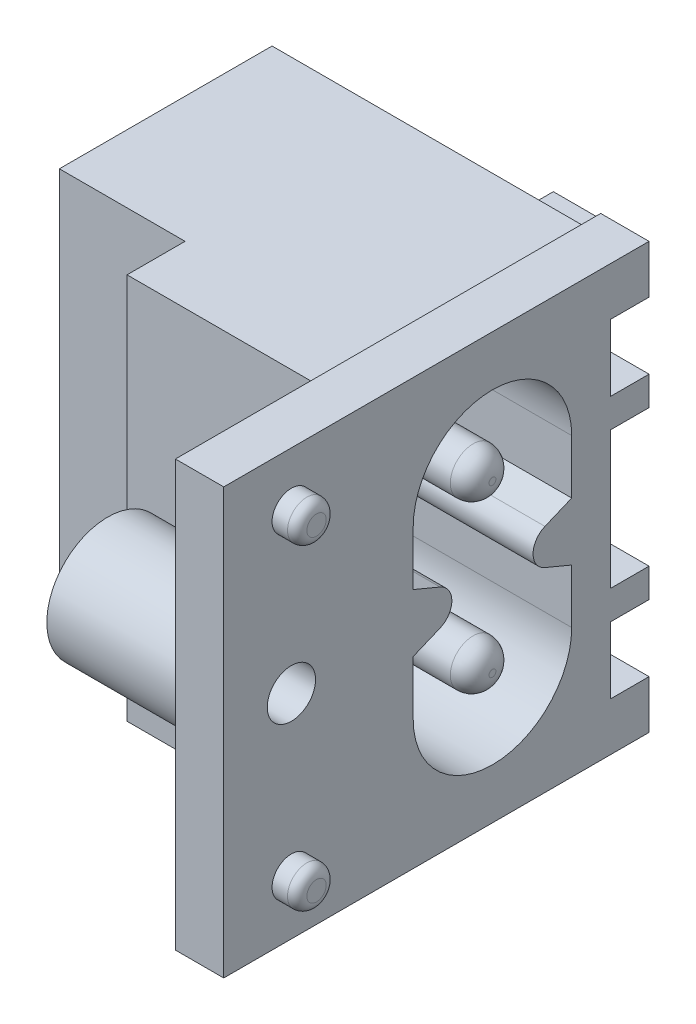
SolidWorks part; units mm, degrees
ref_plane "Front Plane" through (0, 0, 0) normal (0, 0, 1) x (1, 0, 0)
ref_plane "Top Plane" through (0, 0, 0) normal (0, 1, 0) x (1, 0, 0)
ref_plane "Right Plane" through (0, 0, 0) normal (1, 0, 0) x (0, 0, -1)
sketch "Sketch1" plane through (0, 0, 0) normal (0, 0, 1) x (1, 0, 0)
  line L0 (-19.5, 10) -> (-2.5, 10)
  line L1 (-2.5, 11) -> (0, 11)
  line L2 (-19.5, 10) -> (-19.5, -10)
  line L3 (-2.5, -11) -> (0, -11)
  line L4 (0, 11) -> (0, -11)
  line L5 (-2.5, 10) -> (-2.5, 11)
  line L6 (-19.5, -10) -> (-2.5, -10)
  line L7 (-2.5, -10) -> (-2.5, -11)
  line L8 (0, 0) -> (-19.5, 0) construction
  point P4 (0, 0)
  dimension "D1" = 19.5
  dimension "D2" = 22
  dimension "D3" = 20
  dimension "D4" = 2.5
extrude "Boss-Extrude1" add sketch "Sketch1" along normal blind 22
sketch "Sketch5" plane through (0, 0, 0) normal (1, 0, 0) x (0, 0, -1)
  line L0 (-22, 0) -> (0, 0) construction
  line L1 (-22, -11) -> (-22, 11) construction
  line L2 (-8.1, -4.3) -> (-8.1, 4.3) construction
  line L3 (-12.2, -4.3) -> (-12.2, -1.5)
  line L4 (-12.2, -1.5) -> (-10.8154, -0.9231)
  line L5 (-10.8154, 0.9231) -> (-12.2, 1.5)
  line L6 (-12.2, 1.5) -> (-12.2, 4.3)
  line L7 (-4, -4.3) -> (-4, -1.5)
  line L8 (-4, -1.5) -> (-5.3846, -0.9231)
  line L9 (-5.3846, 0.9231) -> (-4, 1.5)
  line L10 (-4, 1.5) -> (-4, 4.3)
  line L11 (-12.2, -1.5) -> (-12.2, 1.5) construction
  circle A0 centre (-8.1, -4.3) radius 1.18
  circle A1 centre (-8.1, 4.3) radius 1.18
  arc A2 (-12.2, -4.3) -> (-4, -4.3) centre (-8.1, -4.3) ccw
  arc A3 (-12.2, 4.3) -> (-4, 4.3) centre (-8.1, 4.3) cw
  arc A4 (-10.8154, -0.9231) -> (-10.8154, 0.9231) centre (-11.2, 0) ccw
  arc A5 (-5.3846, -0.9231) -> (-5.3846, 0.9231) centre (-5, 0) cw
  circle A6 centre (-18.5, 0) radius 1.25
  point P7 (-8.1, 0)
  point P23 (-10.2, 0)
  point P25 (-6, 0)
  point P26 (-12.2, 0)
  dimension "D1" = 2.36
  dimension "D2" = 8.6
  dimension "D3" = 4.2
  dimension "D4" = 1
  dimension "D6" = 8.1
  dimension "D7" = 3
  dimension "D9" = 2.5
  dimension "D5" = 8.2
  dimension "D8" = 18.5
extrude "Cut-Extrude1" cut sketch "Sketch5" against normal blind 10
sketch "Sketch6" plane through (0, 0, 0) normal (0, 1, 0) x (1, 0, 0)
  line L0 (-19.5, -22) -> (-2.5, -22)
  line L1 (-2.5, -22) -> (-2.5, -21.8)
  line L2 (-2.5, -22) -> (-2.5, 0) construction
  line L3 (-2.5, -21.8) -> (-9.5, -21.8)
  line L4 (-9.5, -21.8) -> (-9.5, -14)
  line L5 (-9.5, -14) -> (-13, -14)
  line L6 (-13, -14) -> (-13, -11)
  line L7 (-13, -11) -> (-19.5, -11)
  line L8 (-19.5, -22) -> (-19.5, 0) construction
  line L9 (-19.5, -11) -> (-19.5, -22)
  line L10 (-19.5, 0) -> (-2.5, 0) construction
  line L11 (0, -22) -> (0, 0) construction
  dimension "D1" = 14
  dimension "D2" = 11
  dimension "D3" = 10
  dimension "D4" = 13
  dimension "D5" = 0.2
extrude "Cut-Extrude2" cut sketch "Sketch6" against normal through all and the other way through all
sketch "Sketch7" plane through (0, 0, 0) normal (1, 0, 0) x (0, 0, -1)
  line L0 (-14, 0.75) -> (-15.4406, 0.75)
  line L1 (-14, -10) -> (-14, 10) construction
  line L2 (-14, -0.75) -> (-15.4406, -0.75)
  line L3 (-14, -0.75) -> (-14, -11)
  line L4 (-22, -11) -> (0, -11) construction
  line L5 (-14, -11) -> (-22, -11)
  line L6 (-22, -11) -> (-22, 11)
  line L7 (-22, 11) -> (-14, 11)
  line L8 (-22, 11) -> (0, 11) construction
  line L9 (-14, 11) -> (-14, 0.75)
  line L10 (-15.4406, 0.75) -> (-15.4406, -0.75) construction
  line L11 (-18.5, 0) -> (-15.4406, 0) construction
  arc A0 (-15.4406, 0.75) -> (-15.4406, -0.75) centre (-18.5, 0) ccw
  dimension "D1" = 6.3
  dimension "D2" = 1.5
extrude "Cut-Extrude3" cut sketch "Sketch7" against normal through all from offset 2.5
sketch "Sketch8" plane through (0, 0, 0) normal (1, 0, 0) x (0, 0, -1)
  line L0 (0, 8.5) -> (-9.5, 8.5)
  line L1 (0, 10) -> (0, -10) construction
  line L2 (-9.5, 8.5) -> (-9.5, 0.75)
  line L3 (-9.5, 0.75) -> (-1.8, 0.75)
  line L4 (-1.8, 0.75) -> (-1.8, -0.75)
  line L5 (-1.8, -0.75) -> (-9.5, -0.75)
  line L6 (-9.5, -0.75) -> (-9.5, -8.5)
  line L7 (-9.5, -8.5) -> (0, -8.5)
  line L8 (0, -8.5) -> (0, 8.5)
  line L9 (-5.65, 0.75) -> (-5.65, -0.75) construction
  line L10 (-4.75, 8.5) -> (-4.75, 10) construction
  line L11 (-11, 10) -> (0, 10) construction
  line L12 (-9.5, 4.625) -> (-11, 4.625) construction
  line L13 (-11, -10) -> (-11, 10) construction
  line L14 (-5.65, 0) -> (0, 0) construction
  dimension "D1" = 1.5
  dimension "D2" = 1.8
extrude "Cut-Extrude4" cut sketch "Sketch8" against normal through all from offset 17.81
sketch "Sketch9" plane through (0, 0, 0) normal (0, 0, 1) x (1, 0, 0)
  line L0 (-17.81, 8.5) -> (0, 8.5)
  line L1 (0, -11) -> (0, 11) construction
  line L2 (0, 8.5) -> (0, 5.05)
  line L3 (0, 5.05) -> (-13.31, 5.05)
  line L4 (-13.31, 5.05) -> (-13.31, 6.5)
  line L5 (-13.31, 6.5) -> (-17.81, 6.5)
  line L6 (-17.81, 8.5) -> (-17.81, 0.75) construction
  line L7 (-17.81, 6.5) -> (-17.81, 8.5)
  line L8 (-17.81, -8.5) -> (0, -8.5)
  line L9 (0, -8.5) -> (0, -5.05)
  line L10 (0, -5.05) -> (-13.31, -5.05)
  line L11 (-13.31, -5.05) -> (-13.31, -6.5)
  line L12 (-13.31, -6.5) -> (-17.81, -6.5)
  line L13 (-17.81, -8.5) -> (-17.81, 8.5) construction
  line L14 (-17.81, -6.5) -> (-17.81, -8.5)
  line L16 (0, 3.55) -> (0, -3.55)
  line L17 (0, -3.55) -> (-13.31, -3.55)
  line L18 (-13.31, -3.55) -> (-13.31, -2.1)
  line L19 (-13.31, -2.1) -> (-19.5, -2.1)
  line L20 (-19.5, -0.75) -> (-19.5, -8.5) construction
  line L21 (-19.5, -2.1) -> (-19.5, 2.1)
  line L22 (-19.5, 8.5) -> (-19.5, 0.75) construction
  line L23 (-19.5, 2.1) -> (-13.31, 2.1)
  line L24 (-13.31, 2.1) -> (-13.31, 3.55)
  line L25 (-13.31, 3.55) -> (0, 3.55)
  line L26 (-8.905, 8.5) -> (-8.905, 10) construction
  line L27 (-2.5, 10) -> (-19.5, 10) construction
  line L28 (-6.655, 5.05) -> (-6.655, 3.55) construction
  line L29 (-6.655, -3.55) -> (-6.655, -5.05) construction
  line L30 (-15.7, 5.05) -> (-19.5, 5.05)
  line L31 (-15.7, 5.05) -> (-15.7, 3.55)
  line L32 (-15.7, 3.55) -> (-19.5, 3.55)
  line L33 (-19.5, 5.05) -> (-19.5, 3.55)
  line L34 (-15.7, -3.55) -> (-19.5, -3.55)
  line L35 (-15.7, -3.55) -> (-15.7, -5.05)
  line L36 (-15.7, -5.05) -> (-19.5, -5.05)
  line L37 (-19.5, -3.55) -> (-19.5, -5.05)
  dimension "D1" = 4.5
  dimension "D2" = 3.45
  dimension "D3" = 2
  dimension "D4" = 15.7
extrude "Cut-Extrude5" cut sketch "Sketch9" along normal blind 2
sketch "Sketch10" plane through (0, 0, 0) normal (1, 0, 0) x (0, 0, -1)
  line L0 (0, 6.5) -> (-7, 6.5)
  line L1 (0, 6.5) -> (0, 8.5)
  line L2 (0, 8.5) -> (-9.5, 8.5)
  line L3 (-9.5, 8.5) -> (-9.5, 0.75)
  line L4 (-9.5, 0.75) -> (0, 0.75)
  line L5 (0, 0.75) -> (0, 2.1)
  line L6 (0, 2.1) -> (-7, 2.1)
  line L7 (-7, 2.1) -> (-7, 6.5)
  line L8 (0, -8.5) -> (-9.5, -8.5)
  line L9 (-9.5, -0.75) -> (-9.5, -8.5) construction
  line L10 (-9.5, -8.5) -> (-2, -8.5) construction
  line L11 (-9.5, -8.5) -> (-9.5, -0.75)
  line L12 (-9.5, -0.75) -> (0, -0.75)
  line L13 (0, -0.75) -> (0, -2.1)
  line L14 (0, -2.1) -> (-7, -2.1)
  line L15 (-7, -2.1) -> (-7, -6.5)
  line L16 (-7, -6.5) -> (0, -6.5)
  line L17 (0, -6.5) -> (0, -5.05) construction
  line L18 (-2, -6.5) -> (0, -6.5) construction
  line L19 (0, -6.5) -> (0, -8.5)
  dimension "D1" = 7
extrude "Cut-Extrude6" cut sketch "Sketch10" along normal up to vertex (-13.31 mm away) from vertex at -19.5
sketch "Sketch12" plane through (0, 0, 0) normal (0, 0, 1) x (1, 0, 0)
  line L0 (-5.3, 6.4) -> (-5.3, -6.4) construction
  line L1 (-5.3, 7.4) -> (-8.3, 7.4)
  line L2 (-5.3, 7.4) -> (-5.3, 6.4)
  line L3 (-5.3, 6.4) -> (-8.3, 6.4)
  line L4 (-8.3, 7.4) -> (-8.3, 6.4)
  line L5 (-5.3, -7.4) -> (-8.3, -7.4)
  line L6 (-5.3, -7.4) -> (-5.3, -6.4)
  line L7 (-5.3, -6.4) -> (-8.3, -6.4)
  line L8 (-8.3, -7.4) -> (-8.3, -6.4)
  line L9 (0, 0) -> (-5.3, 0) construction
  line L10 (0, -3.55) -> (0, 3.55) construction
  dimension "D1" = 5.3
  dimension "D2" = 3
  dimension "D3" = 14.8
  dimension "D4" = 12.8
extrude "Boss-Extrude2" add sketch "Sketch12" against normal blind 1.75 and the other way up to vertex (2 mm away)
sketch "Sketch13" plane through (0, 0, 0) normal (1, 0, 0) x (0, 0, -1)
  line L0 (1.75, 7.4) -> (3.35, 7.4)
  line L1 (3.35, 7.4) -> (3.35, 7)
  line L2 (3.35, 7) -> (1.75, 5.8)
  line L3 (1.75, 5.8) -> (1.75, 7.4)
  line L4 (1.75, -7.4) -> (3.35, -7.4)
  line L5 (3.35, -7.4) -> (3.35, -7)
  line L6 (3.35, -7) -> (1.75, -5.8)
  line L7 (1.75, -5.8) -> (1.75, -7.4)
  dimension "D1" = 14.8
  dimension "D2" = 14
  dimension "D3" = 11.6
  dimension "D4" = 1.6
extrude "Boss-Extrude3" add sketch "Sketch13" against normal up to vertex (8.3 mm away) from vertex at -5.3
sketch "Sketch14" plane through (0, 0, 0) normal (0, 0, 1) x (1, 0, 0)
  line L0 (-15.7, 3.55) -> (-15.7, 5.05) construction
  line L1 (-15.575, 4.8) -> (-15.825, 4.8)
  line L2 (-15.575, 4.8) -> (-15.575, 3.8)
  line L3 (-15.575, 3.8) -> (-15.825, 3.8)
  line L4 (-15.825, 4.8) -> (-15.825, 3.8)
  line L5 (-15.575, 4.8) -> (-15.825, 3.8) construction
  line L6 (-15.575, 3.8) -> (-15.825, 4.8) construction
  line L7 (-15.7, -5.05) -> (-15.7, -3.55) construction
  line L8 (-15.575, -3.8) -> (-15.825, -3.8)
  line L9 (-15.575, -3.8) -> (-15.575, -4.8)
  line L10 (-15.575, -4.8) -> (-15.825, -4.8)
  line L11 (-15.825, -3.8) -> (-15.825, -4.8)
  line L12 (-15.575, -3.8) -> (-15.825, -4.8) construction
  line L13 (-15.575, -4.8) -> (-15.825, -3.8) construction
  point P0 (-15.7, 4.3)
  point P7 (-15.7, -4.3)
  dimension "D1" = 0.25
  dimension "D2" = 8.6
  dimension "D3" = 1
extrude "Boss-Extrude4" add sketch "Sketch14" along normal blind 3 and the other way blind 4.1
fillet "Fillet1" radius 1 2 edges at (0, -4.3, 6.92) (0, 4.3, 6.92)
fillet "Fillet2" radius 0.4 4 edges at (-15.7, 3.8, -4.1) (-15.7, 4.8, -4.1) (-15.7, -3.8, -4.1) (-15.7, -4.8, -4.1)
sketch "Sketch15" plane through (0, 0, 0) normal (1, 0, 0) x (0, 0, -1)
  line L0 (-18.5, 0) -> (-18.5, 8.1913) construction
  line L1 (-18.5, 0) -> (-18.5, -8.1913) construction
  circle A0 centre (-18.5, 8.1913) radius 1
  circle A1 centre (-18.5, -8.1913) radius 1
  dimension "D1" = 2
extrude "Boss-Extrude5" add sketch "Sketch15" along normal blind 1.3
fillet "Fillet3" radius 0.5 2 edges at (1.3, 8.1913, 17.5) (1.3, -8.1913, 17.5)
